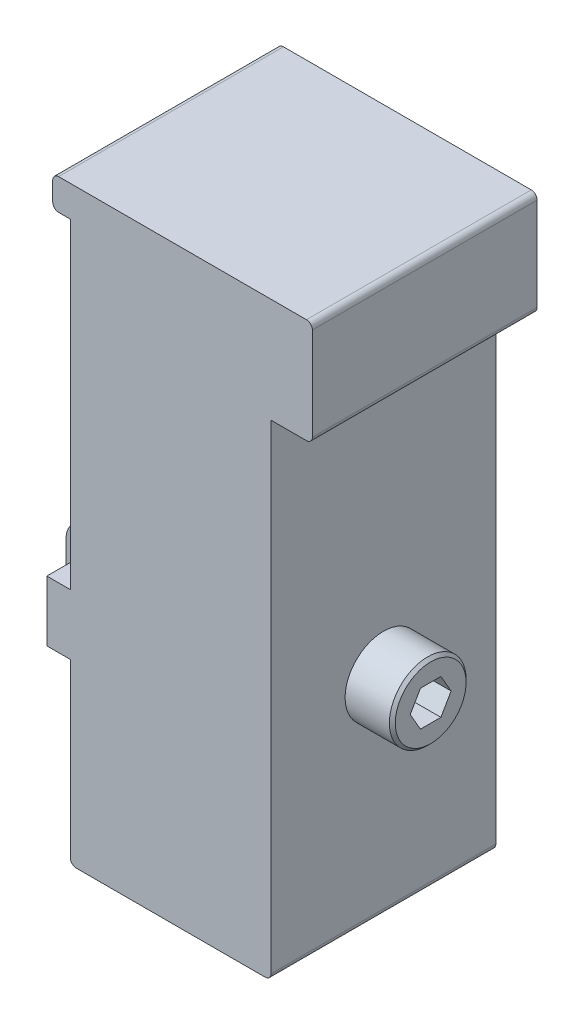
SolidWorks part; units mm, degrees
ref_plane "Front Plane" through (0, 0, 0) normal (0, 0, 1) x (1, 0, 0)
ref_plane "Top Plane" through (0, 0, 0) normal (0, 1, 0) x (1, 0, 0)
ref_plane "Right Plane" through (0, 0, 0) normal (1, 0, 0) x (0, 0, -1)
imported_body "P-00530-1-solid1"
imported_body "LIB M8 SS SHCS-50-solid1"
imported_body "LIB BOSCH SLOT NUT 10mm SLOT-18-solid1"
ref_plane "Plane1" through (168, 0, 0) normal (-1, 0, 0) x (0, 0, 1)
ref_plane "Plane2" through (185, 0, 0) normal (-1, 0, 0) x (0, 0, 1)
ref_plane "Plane3" through (0, 80.5, 0) normal (0, -1, 0) x (-1, 0, 0)
mirror "Mirror1" about plane through (185, 0, 0) normal (-1, 0, 0)
delete or keep bodies "Body-Delete/Keep 1" type delete bodies bodies 101
